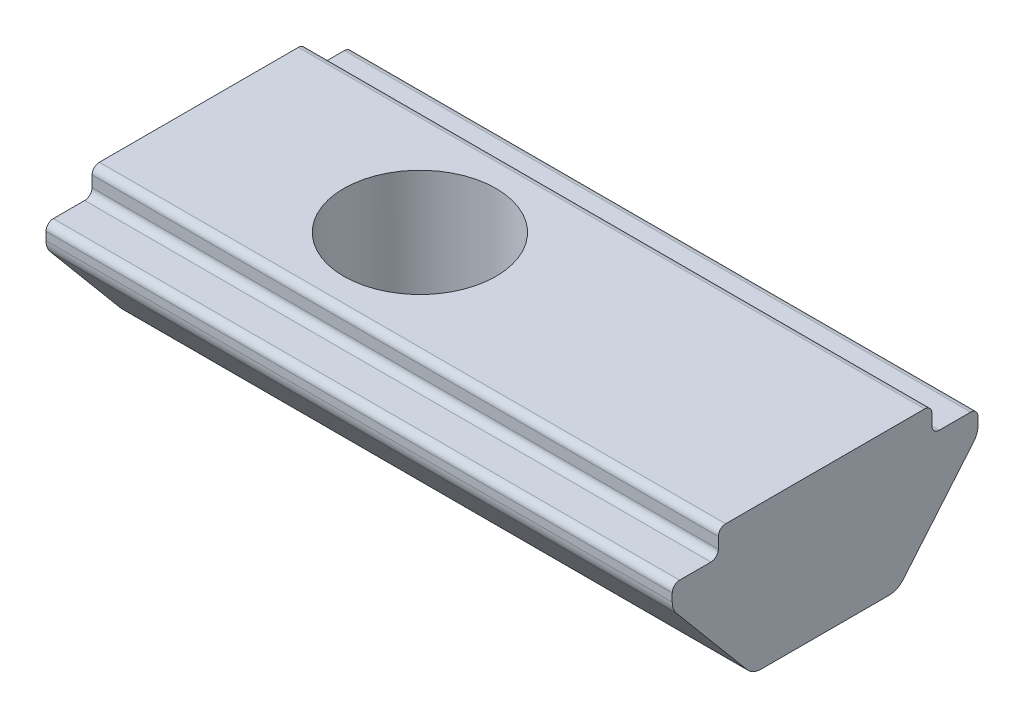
SolidWorks part; units mm, degrees
ref_plane "Front Plane" through (0, 0, 0) normal (0, 0, 1) x (1, 0, 0)
ref_plane "Top Plane" through (0, 0, 0) normal (0, 1, 0) x (1, 0, 0)
ref_plane "Right Plane" through (0, 0, 0) normal (1, 0, 0) x (0, 0, -1)
ref_plane "Plane1" through (-6, 0, 0) normal (1, 0, 0) x (0, 0, -1)
sketch "Sketch1" plane through (-6, 0, 0) normal (1, 0, 0) x (0, 0, -1)
  line L0 (2.9, 0.7) -> (-2.9, 0.7)
  line L1 (-2.9, 0.7) -> (-2.9, 0)
  line L2 (-2.9, 0) -> (-4.15, 0)
  line L3 (-4.15, 0) -> (-4.15, -0.6)
  line L4 (-4.15, -0.6) -> (-1.9683, -3.2)
  line L5 (-1.9683, -3.2) -> (1.9683, -3.2)
  line L6 (1.9683, -3.2) -> (4.15, -0.6)
  line L7 (4.15, -0.6) -> (4.15, 0)
  line L8 (4.15, 0) -> (2.9, 0)
  line L9 (2.9, 0) -> (2.9, 0.7)
  line L10 (0, 0.7) -> (0, -3.2) construction
  point P1 (-3.525, 0)
  point P15 (-4.15, -0.6)
  point P18 (-1.9683, -3.2)
  point P24 (4.15, -0.6)
  dimension "FIX_2" = 8.3
  dimension "FIX_3" = 5.8
  dimension "FIX_4" = 3.9
  dimension "FIX_5" = 3.2
  dimension "FIX_7" = 50
  dimension "FIX_6" = 2.6
extrude "Boss-Extrude1" add sketch "Sketch1" along normal blind 17
fillet "Fillet1" radius 0.2 6 edges at (2.5, 0.7, -2.9) (2.5, 0.7, 2.9) (2.5, 0, -2.9) (2.5, 0, 2.9) (2.5, 0, -4.15) (2.5, 0, 4.15)
fillet "Fillet2" radius 0.5 4 edges at (2.5, -0.6, -4.15) (2.5, -0.6, 4.15) (2.5, -3.2, -1.9683) (2.5, -3.2, 1.9683)
ref_plane "Plane2" through (6.5, 0, 0) normal (1, 0, 0) x (0, 0, -1)
sketch "Sketch2" plane through (6.5, 0, 0) normal (1, 0, 0) x (0, 0, -1)
  line L0 (0, 0) -> (0, -3.2) construction
  line L1 (0, -3.2) -> (1.75, -3.2)
  line L2 (1.75, -3.2) -> (1.75, -2.25)
  line L3 (1.75, -2.25) -> (0, -2.25)
  line L4 (0, -3.2) -> (0, -2.25)
  dimension "FIX_13" = 3.5
  dimension "FIX_12" = 0.95
revolve "Cut-Revolve1" cut sketch "Sketch2" angle 360 about L0
sketch "Sketch3" plane through (6.5, 0, 0) normal (1, 0, 0) x (0, 0, -1)
  line L0 (0, 0) -> (0, -4) construction
  line L1 (-1.75, -2.25) -> (0, -2.25)
  line L2 (0, -4) -> (0, -2.25)
  arc A0 (-1.75, -2.25) -> (0, -4) centre (0, -2.25) ccw
  dimension "FIX_16" = 1.75
  dimension "FIX_15" = 4
revolve "Revolve1" add sketch "Sketch3" angle 360 about L0
hole_wizard "Tap1" positions "Sketch5" profile "Sketch4" hole size "M5x0.8" standard "JIS"
sketch "Sketch5" plane through (0, 0.7, 0) normal (0, 1, 0) x (1, 0, 0)
  point P0 (0, 0)
sketch "Sketch4" plane through (0, 0.7, 0) normal (1, 0, 0) x (0, 0, 1)
  line L0 (0, 0) -> (0, 4.7)
  line L1 (0, 4.7) -> (2.067, 4.7)
  line L2 (2.067, 4.7) -> (2.067, 0)
  line L5 (2.067, 0) -> (0, 0)
  line L11 (0, 0) -> (0, 4.7) construction
  dimension "Thru Hole Dia." = 4.134
  dimension "Thru Hole Depth" = 4.7
ref_plane "Plane3" [suppressed] through (-6.5, 0, 0) normal (1, 0, 0) x (0, 0, -1)
sketch "Sketch6" [suppressed] plane through (-6.5, 0, 0) normal (1, 0, 0) x (0, 0, -1)
  line L0 (3.9, 0.5) -> (-3.9, 0.5)
  line L1 (-3.9, 0.5) -> (-3.9, 0)
  line L2 (-3.9, 0) -> (-5.75, 0)
  line L3 (-5.75, 0) -> (-5.75, -1.6)
  line L4 (-5.75, -1.6) -> (-2.1566, -6.3)
  line L5 (-2.1566, -6.3) -> (2.1566, -6.3)
  line L6 (2.1566, -6.3) -> (5.75, -1.6)
  line L7 (5.75, -1.6) -> (5.75, 0)
  line L8 (5.75, 0) -> (3.9, 0)
  line L9 (3.9, 0) -> (3.9, 0.5)
  line L10 (0, 0.5) -> (0, -6.3) construction
  point P1 (-4.825, 0)
  point P15 (-5.75, -1.6)
  point P18 (-2.1566, -6.3)
  point P24 (5.75, -1.6)
  dimension "FIX_19" = 11.5
  dimension "FIX_20" = 7.8
  dimension "FIX_21" = 6.8
  dimension "FIX_22" = 6.3
  dimension "FIX_23" = 4.7
  dimension "FIX_24" = 52.6
extrude "Boss-Extrude2" [suppressed] add sketch "Sketch6" along normal blind 17
fillet "Fillet3" [suppressed] radius 0.1
fillet "Fillet4" [suppressed] radius 0.2
fillet "Fillet5" [suppressed] radius 0.5
fillet "Fillet6" [suppressed] radius 1
ref_plane "Plane4" [suppressed] through (6.5, 0, 0) normal (1, 0, 0) x (0, 0, -1)
sketch "Sketch7" [suppressed] plane through (6.5, 0, 0) normal (1, 0, 0) x (0, 0, -1)
  line L0 (0, 0) -> (0, -6.3) construction
  line L1 (0, -6.3) -> (2.25, -6.3)
  line L2 (2.25, -6.3) -> (2.25, -4.75)
  line L3 (2.25, -4.75) -> (0, -4.75)
  line L4 (0, -6.3) -> (0, -4.75)
  dimension "FIX_32" = 4.5
  dimension "FIX_31" = 1.55
revolve "Cut-Revolve2" [suppressed] cut sketch "Sketch7" angle 360 about L0
sketch "Sketch8" [suppressed] plane through (6.5, 0, 0) normal (1, 0, 0) x (0, 0, -1)
  line L0 (0, 0) -> (0, -7) construction
  line L1 (-2.25, -4.75) -> (0, -4.75)
  line L3 (0, -7) -> (0, -4.75)
  arc A0 (-2.25, -4.75) -> (0, -7) centre (0, -4.75) ccw
  dimension "FIX_35" = 2.25
  dimension "FIX_34" = 7
revolve "Revolve2" [suppressed] add sketch "Sketch8" angle 360 about L0
hole_wizard "Tap2" positions "Sketch10" profile "Sketch9" hole size "M6x1.0" standard "JIS"
sketch "Sketch10" [suppressed] plane through (0, 0.5, 0) normal (0, 1, 0) x (1, 0, 0)
  point P0 (0, 0)
sketch "Sketch9" [suppressed] plane through (0, 0.5, 0) normal (1, 0, 0) x (0, 0, 1)
  line L0 (0, 0) -> (0, 7.5)
  line L1 (0, 7.5) -> (2.4585, 7.5)
  line L2 (2.4585, 7.5) -> (2.4585, 0)
  line L5 (2.4585, 0) -> (0, 0)
  line L11 (0, 0) -> (0, 7.5) construction
  dimension "Thru Hole Dia." = 4.917
  dimension "Thru Hole Depth" = 7.5
ref_plane "Plane5" [suppressed] through (-8, 0, 0) normal (1, 0, 0) x (0, 0, -1)
sketch "Sketch11" [suppressed] plane through (-8, 0, 0) normal (1, 0, 0) x (0, 0, -1)
  line L0 (4.9, 0.7) -> (-4.9, 0.7)
  line L1 (-4.9, 0.7) -> (-4.9, 0)
  line L2 (-4.9, 0) -> (-7.25, 0)
  line L3 (-7.25, 0) -> (-7.25, -1.2)
  line L4 (-7.25, -1.2) -> (-4.0641, -5.75)
  line L5 (-1.9995, -6.3) -> (1.9995, -6.3)
  line L6 (4.0641, -5.75) -> (7.25, -1.2)
  line L7 (7.25, -1.2) -> (7.25, 0)
  line L8 (7.25, 0) -> (4.9, 0)
  line L9 (4.9, 0) -> (4.9, 0.7)
  line L10 (0, 0.7) -> (0, -6.3) construction
  line L11 (-4.0641, -5.75) -> (-2.9005, -5.75)
  line L12 (-2.9005, -5.75) -> (-1.9995, -6.3)
  line L13 (4.0641, -5.75) -> (2.9005, -5.75)
  line L14 (2.9005, -5.75) -> (1.9995, -6.3)
  point P2 (-6.075, 0)
  point P15 (-7.25, -1.2)
  point P18 (-3.6789, -6.3)
  point P21 (3.6789, -6.3)
  point P24 (7.25, -1.2)
  dimension "FIX_38" = 14.5
  dimension "FIX_39" = 9.8
  dimension "FIX_40" = 7
  dimension "FIX_41" = 6.3
  dimension "FIX_42" = 0.55
  dimension "FIX_43" = 5.1
  dimension "FIX_44" = 31.4
  dimension "FIX_45" = 55
  dimension "FIX_46" = 3.999
extrude "Boss-Extrude3" [suppressed] add sketch "Sketch11" along normal blind 20
fillet "Fillet7" [suppressed] radius 0.1
fillet "Fillet8" [suppressed] radius 0.2
fillet "Fillet9" [suppressed] radius 0.5
fillet "Fillet10" [suppressed] radius 1
ref_plane "Plane6" [suppressed] through (7.5, 0, 0) normal (1, 0, 0) x (0, 0, -1)
sketch "Sketch12" [suppressed] plane through (7.5, 0, 0) normal (1, 0, 0) x (0, 0, -1)
  line L0 (0, 0) -> (0, -6.3) construction
  line L1 (0, -6.3) -> (2.25, -6.3)
  line L2 (2.25, -6.3) -> (2.25, -4.75)
  line L3 (2.25, -4.75) -> (0, -4.75)
  line L4 (0, -6.3) -> (0, -4.75)
  dimension "FIX_53" = 1.55
  dimension "FIX_54" = 4.5
revolve "Cut-Revolve3" [suppressed] cut sketch "Sketch12" angle 360 about L0
sketch "Sketch13" [suppressed] plane through (7.5, 0, 0) normal (1, 0, 0) x (0, 0, -1)
  line L0 (0, 0) -> (0, -7) construction
  line L1 (-2.25, -4.75) -> (0, -4.75)
  line L2 (0, -7) -> (0, -4.75)
  arc A0 (-2.25, -4.75) -> (0, -7) centre (0, -4.75) ccw
  dimension "FIX_57" = 2.25
  dimension "FIX_56" = 7
revolve "Revolve3" [suppressed] add sketch "Sketch13" angle 360 about L0
hole_wizard "Tap3" positions "Sketch15" profile "Sketch14" hole size "M8x1.25" standard "JIS"
sketch "Sketch15" [suppressed] plane through (0, 0.7, 0) normal (0, 1, 0) x (1, 0, 0)
  point P0 (0, 0)
sketch "Sketch14" [suppressed] plane through (0, 0.7, 0) normal (1, 0, 0) x (0, 0, 1)
  line L0 (0, 0) -> (0, 7.7)
  line L1 (0, 7.7) -> (3.3235, 7.7)
  line L2 (3.3235, 7.7) -> (3.3235, 0)
  line L5 (3.3235, 0) -> (0, 0)
  line L11 (0, 0) -> (0, 7.7) construction
  dimension "Thru Hole Dia." = 6.647
  dimension "Thru Hole Depth" = 7.7
